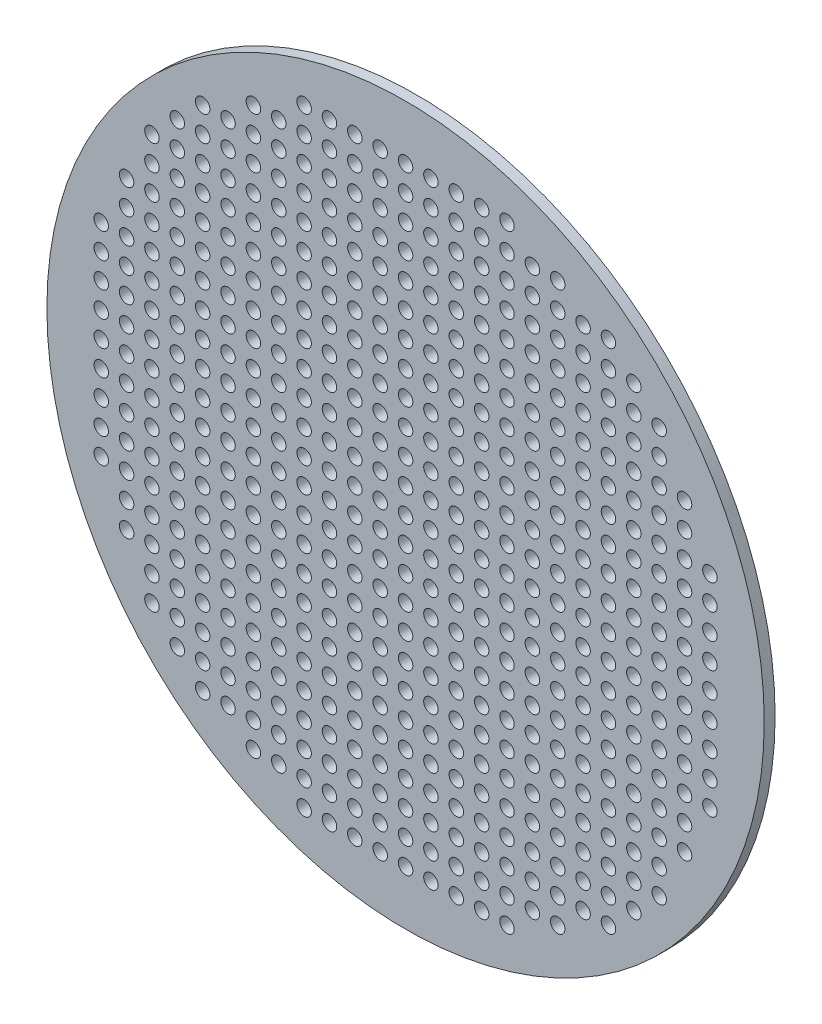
SolidWorks part; units mm, degrees
ref_plane "Front" through (0, 0, 0) normal (0, 0, 1) x (1, 0, 0)
ref_plane "Top" through (0, 0, 0) normal (0, 1, 0) x (1, 0, 0)
ref_plane "Right" through (0, 0, 0) normal (1, 0, 0) x (0, 0, -1)
sketch "Sketch1" plane through (0, 0, 0) normal (0, 0, 1) x (1, 0, 0)
  circle A0 centre (0, 0) radius 12.573 construction
  circle A1 centre (0, 0) radius 11.43 construction
  dimension "D1" = 25.146
  dimension "D2" = 22.86
sketch "Sketch2" plane through (0, 0, 0) normal (0, 0, 1) x (1, 0, 0)
  line L1 (-12.7, 12.7) -> (12.7, 12.7)
  line L2 (-12.7, 12.7) -> (-12.7, -12.7)
  line L3 (-12.7, -12.7) -> (12.7, -12.7)
  line L4 (12.7, 12.7) -> (12.7, -12.7)
  point P4 (12.7, 0)
  point P5 (0, -12.7)
  dimension "D1" = 25.4
extrude "Extrude1" add sketch "Sketch2" along normal blind 0.381
sketch "Sketch3" plane through (0, 0, 0) normal (0, 0, 1) x (1, 0, 0)
  circle A0 centre (0, 0) radius 0.254
  dimension "D1" = 0.508
extrude "Cut-Extrude2" cut sketch "Sketch3" along normal through all
pattern_linear "LPattern1" count 13 spacing 0.889 along (0, 1, 0) count 13 spacing 0.889 along (-1, 0, 0) of "Cut-Extrude2"
mirror "Mirror1" about plane through (0, 0, 0) normal (0, 1, 0) of "LPattern1"
mirror "Mirror2" about plane through (0, 0, 0) normal (1, 0, 0) of "Mirror1", "LPattern1"
sketch "Sketch4" plane through (0, 0, 0) normal (0, 0, 1) x (1, 0, 0)
  circle A0 centre (0, 0) radius 12.573
  circle A1 centre (0, 0) radius 12.573 construction
extrude "Cut-Extrude4" cut sketch "Sketch4" along normal through all flip side to cut
sketch "Sketch5" plane through (0, 0, 0) normal (0, 0, 1) x (1, 0, 0)
  circle A0 centre (0, 0) radius 11.43
  circle A2 centre (0, 0) radius 12.573
  circle A4 centre (0, 0) radius 12.573 construction
  circle A5 centre (0, 0) radius 11.43 construction
extrude "Extrude2" [suppressed] add sketch "Sketch5" along normal blind 0.127
